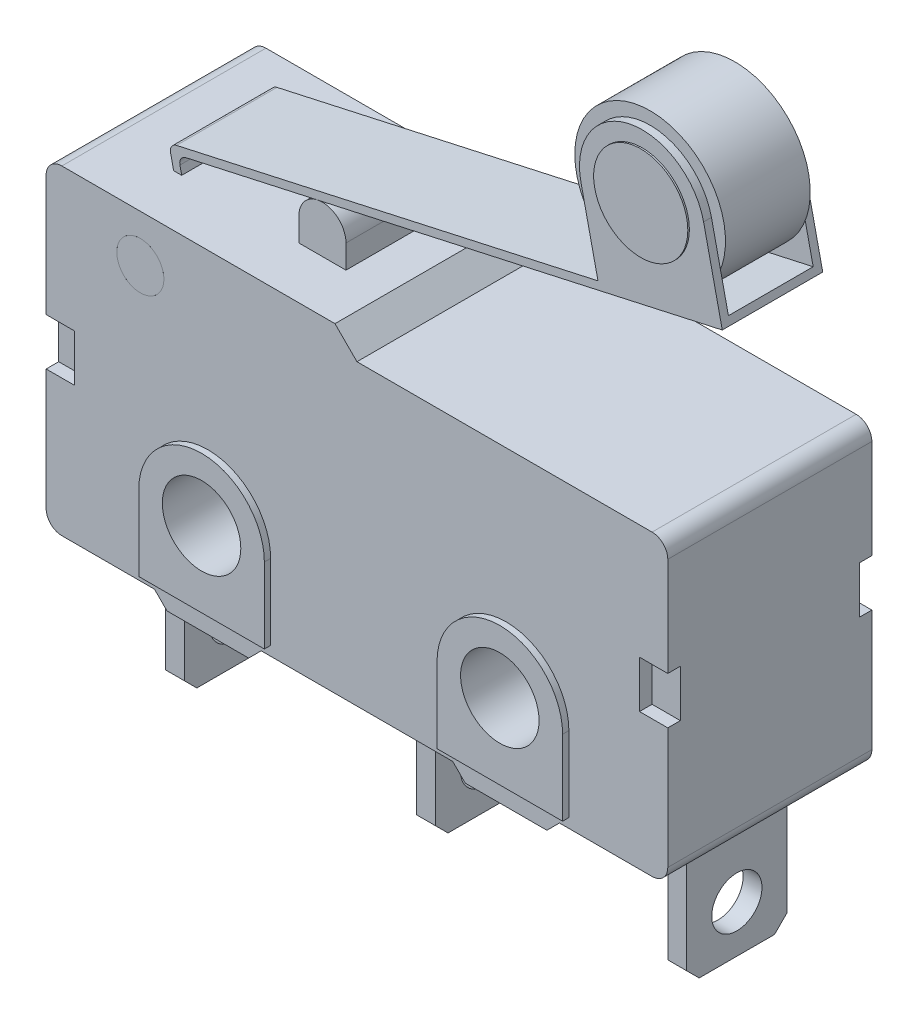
SolidWorks part; units mm, degrees
ref_plane "Front Plane" through (0, 0, 0) normal (0, 0, 1) x (1, 0, 0)
ref_plane "Top Plane" through (0, 0, 0) normal (0, 1, 0) x (1, 0, 0)
ref_plane "Right Plane" through (0, 0, 0) normal (1, 0, 0) x (0, 0, -1)
sketch "Sketch1" plane through (0, 0, 0) normal (0, 0, 1) x (1, 0, 0)
  line L0 (9.2, 10.2) -> (9.9, 9.5)
  line L1 (0.5, 0) -> (19.3, 0)
  line L2 (0, 0.5) -> (0, 9.7)
  line L3 (0.5, 10.2) -> (9.2, 10.2)
  line L4 (19.8, 0.5) -> (19.8, 9)
  line L5 (9.9, 0) -> (9.9, 9.5) construction
  line L6 (0, 5.1) -> (19.8, 5.1) construction
  line L7 (9.9, 9.5) -> (19.3, 9.5)
  arc A0 (19.8, 0.5) -> (19.3, 0) centre (19.3, 0.5) cw
  arc A1 (0.5, 0) -> (0, 0.5) centre (0.5, 0.5) cw
  arc A2 (19.8, 9) -> (19.3, 9.5) centre (19.3, 9) ccw
  arc A3 (0, 9.7) -> (0.5, 10.2) centre (0.5, 9.7) cw
  point P11 (19.8, 0)
  point P15 (0, 0)
  point P18 (19.8, 9.5)
  point P21 (0, 10.2)
  dimension "D5" = 0.5
  dimension "D1" = 10.2
  dimension "D2" = 9.5
  dimension "D3" = 19.8
  dimension "D4" = 45
extrude "Boss-Extrude1" add sketch "Sketch1" along normal mid plane 6.5
sketch "Sketch2" plane through (0, 0, 0) normal (0, 0, 1) x (1, 0, 0)
  line L0 (0.5, 0) -> (19.3, 0) construction
  line L1 (2.15, 0) -> (2.75, 0)
  line L2 (2.15, 0) -> (2.15, -4.1)
  line L3 (2.15, -4.1) -> (2.75, -4.1)
  line L4 (2.75, 0) -> (2.75, -4.1)
  line L5 (9.9, 0) -> (9.9, 9.5) construction
  line L6 (10.15, 0) -> (10.75, 0)
  line L7 (10.15, 0) -> (10.15, -4.1)
  line L8 (10.15, -4.1) -> (10.75, -4.1)
  line L9 (10.75, 0) -> (10.75, -4.1)
  line L10 (18.15, 0) -> (18.75, 0)
  line L11 (18.15, 0) -> (18.15, -4.1)
  line L12 (18.15, -4.1) -> (18.75, -4.1)
  line L13 (18.75, 0) -> (18.75, -4.1)
  dimension "D1" = 4.1
  dimension "D2" = 0.6
  dimension "D3" = 0.6
  dimension "D4" = 0.6
  dimension "D5" = 0.5
  dimension "D6" = 7.4
  dimension "D7" = 7.4
extrude "Boss-Extrude2" add sketch "Sketch2" along normal mid plane 3.2
sketch "Sketch3" plane through (18.75, 0, 0) normal (1, 0, 0) x (0, 0, -1)
  line L0 (0, -4.1) -> (0, 0) construction
  line L1 (-1.6, -4.1) -> (1.6, -4.1) construction
  line L2 (1.2, -4.1) -> (1.6, -3.7)
  line L3 (1.6, -4.1) -> (1.6, 0) construction
  line L4 (1.6, -3.7) -> (1.6, -4.1)
  line L5 (1.6, -4.1) -> (1.2, -4.1)
  line L6 (-1.6, -4.1) -> (-1.2, -4.1)
  line L7 (-1.6, -3.7) -> (-1.6, -4.1)
  line L8 (-1.2, -4.1) -> (-1.6, -3.7)
  circle A0 centre (0, -2.6) radius 0.8
  dimension "D1" = 1.6
  dimension "D2" = 1.5
  dimension "D3" = 0.4
  dimension "D4" = 0.4
extrude "Cut-Extrude1" cut sketch "Sketch3" against normal through all
sketch "Sketch5" plane through (0, 0, 3.25) normal (0, 0, 1) x (1, 0, 0)
  line L0 (5.15, 2.7) -> (14.65, 2.7) construction
  line L1 (9.9, 0) -> (9.9, 9.5) construction
  line L2 (0.5, 0) -> (19.3, 0) construction
  line L3 (0, 5.1) -> (9.9, 5.1) construction
  line L4 (0, 9.7) -> (0, 0.5) construction
  circle A0 centre (5.15, 2.7) radius 1.25
  circle A1 centre (14.65, 2.7) radius 1.25
  dimension "D1" = 2.5
  dimension "D2" = 9.5
  dimension "D3" = 4.75
  dimension "D4" = 2.4
extrude "Cut-Extrude2" cut sketch "Sketch5" against normal through all
sketch "Sketch6" plane through (0, 0, 3.25) normal (0, 0, 1) x (1, 0, 0)
  line L0 (3.15, 0.3) -> (7.15, 0.3)
  line L1 (3.15, 2.7) -> (3.15, 0.3)
  line L2 (7.15, 2.7) -> (7.15, 0.3)
  line L3 (12.65, 2.7) -> (12.65, 0.3)
  line L4 (16.65, 2.7) -> (16.65, 0.3)
  line L5 (12.65, 0.3) -> (16.65, 0.3)
  line L6 (0.5, 0) -> (19.3, 0) construction
  circle A0 centre (5.15, 2.7) radius 1.25
  circle A1 centre (14.65, 2.7) radius 1.25
  arc A2 (16.65, 2.7) -> (12.65, 2.7) centre (14.65, 2.7) ccw
  arc A3 (7.15, 2.7) -> (3.15, 2.7) centre (5.15, 2.7) ccw
  dimension "D2" = 2
  dimension "D3" = 2.5
  dimension "D1" = 0.3
extrude "Boss-Extrude3" add sketch "Sketch6" along normal blind 0.2
mirror "Mirror1" about plane through (0, 0, 0) normal (0, 0, 1) of "Boss-Extrude3"
sketch "Sketch7" plane through (0, 0, 3.25) normal (0, 0, 1) x (1, 0, 0)
  line L0 (3.45, 0) -> (3.85, -0.4)
  line L1 (0.5, 0) -> (19.3, 0) construction
  line L2 (3.85, -0.4) -> (6.45, -0.4)
  line L3 (6.45, -0.4) -> (6.85, 0)
  line L4 (12.95, 0) -> (13.35, -0.4)
  line L5 (13.35, -0.4) -> (15.95, -0.4)
  line L6 (15.95, -0.4) -> (16.35, 0)
  line L7 (16.35, 0) -> (12.95, 0)
  line L8 (6.85, 0) -> (3.45, 0)
  line L9 (5.15, -0.4) -> (5.15, 2.7) construction
  line L10 (14.65, -0.4) -> (14.65, 2.7) construction
  dimension "D1" = 45
  dimension "D2" = 45
  dimension "D3" = 45
  dimension "D4" = 0.4
  dimension "D5" = 0.3
  dimension "D6" = 0.3
extrude "Boss-Extrude4" add sketch "Sketch7" against normal up to surface (6.5 mm away)
sketch "Sketch8" plane through (0, 0, 3.25) normal (0, 0, 1) x (1, 0, 0)
  line L0 (0, 5.1) -> (20.8743, 5.1) construction
  line L1 (0, 9.7) -> (0, 0.5) construction
  line L2 (9.9, 0) -> (9.9, 5.1) construction
  line L3 (0, 5.85) -> (0.9, 5.85)
  line L4 (0, 5.85) -> (0, 4.35)
  line L5 (0, 4.35) -> (0.9, 4.35)
  line L6 (0.9, 5.85) -> (0.9, 4.35)
  line L7 (6.85, 0) -> (12.95, 0) construction
  line L8 (19.8, 5.85) -> (19.8, 4.35)
  line L9 (19.8, 4.35) -> (18.9, 4.35)
  line L10 (18.9, 5.85) -> (18.9, 4.35)
  line L11 (19.8, 5.85) -> (18.9, 5.85)
  dimension "D1" = 0.9
  dimension "D2" = 1.5
  dimension "D3" = 0.75
extrude "Cut-Extrude3" cut sketch "Sketch8" against normal blind 0.4
mirror "Mirror2" about plane through (0, 0, 0) normal (0, 0, 1) of "Cut-Extrude3"
sketch "Sketch9" plane through (0, 0, 3.25) normal (0, 0, 1) x (1, 0, 0)
  line L0 (9.2, 10.2) -> (0.5, 10.2) construction
  line L1 (0, 9.7) -> (0, 5.85) construction
  circle A0 centre (3, 8.7) radius 0.75
  dimension "D1" = 1.5
  dimension "D2" = 1.5
  dimension "D3" = 3
extrude "Cut-Extrude4" cut sketch "Sketch9" against normal through all
sketch "Sketch10" plane through (0, 0, 0) normal (0, 0, 1) x (1, 0, 0)
  circle A0 centre (3, 8.7) radius 0.75
  dimension "D1" = 1.5
extrude "Boss-Extrude6" add sketch "Sketch10" along normal mid plane 6.5 separate body
sketch "Sketch11" plane through (0, 10.2, 0) normal (0, 1, 0) x (1, 0, 0)
  line L0 (0, 0) -> (6.4, 0) construction
  line L1 (6.4, 1.6) -> (7.9, 1.6)
  line L2 (6.4, 1.6) -> (6.4, -1.6)
  line L3 (6.4, -1.6) -> (7.9, -1.6)
  line L4 (7.9, 1.6) -> (7.9, -1.6)
  line L5 (9.2, -3.25) -> (9.2, 3.25) construction
  dimension "D1" = 3.2
  dimension "D2" = 1.3
  dimension "D3" = 1.5
extrude "Boss-Extrude7" add sketch "Sketch11" along normal blind 0.75 separate body
sketch "Sketch12" plane through (0, 0, 1.6) normal (0, 0, 1) x (1, 0, 0)
  line L0 (6.4, 10.95) -> (7.9, 10.95) construction
  line L1 (6.4, 10.95) -> (7.9, 10.95)
  arc A0 (7.9, 10.95) -> (6.4, 10.95) centre (7.15, 10.95) ccw
extrude "Boss-Extrude8" add sketch "Sketch12" against normal up to surface (3.2 mm away)
sketch "Sketch13" plane through (0, 0, 0) normal (0, 0, 1) x (1, 0, 0)
  line L0 (2.8007, 10.754) -> (19.8859, 14.5417)
  line L1 (2.4114, 10.2) -> (2.3126, 10.6458)
  line L2 (2.5025, 10.944) -> (19.8318, 14.7858)
  line L3 (3, 8.7) -> (3, 13.8125) construction
  line L4 (2.6675, 10.2) -> (2.6107, 10.4558)
  line L5 (3.8176, 10.9794) -> (17.7373, 14.0654) construction
  line L6 (9.2, 10.2) -> (0.5, 10.2) construction
  line L7 (3.7635, 11.2235) -> (17.6832, 14.3094) construction
  line L8 (2.7559, 8.6459) -> (2.3126, 10.6458) construction
  line L10 (19.8859, 14.5417) -> (19.8318, 14.7858)
  line L11 (3, 8.7) -> (2.5566, 10.6999) construction
  line L12 (2.6675, 10.2) -> (2.4114, 10.2)
  arc A0 (7.9, 10.95) -> (6.4, 10.95) centre (7.15, 10.95) ccw construction
  arc A1 (2.3126, 10.6458) -> (2.5025, 10.944) centre (2.5566, 10.6999) cw
  arc A2 (2.6107, 10.4558) -> (2.8007, 10.754) centre (2.8548, 10.5099) cw
  dimension "D4" = 0.25
  dimension "D5" = 18
  dimension "D1" = 0.25
  dimension "D3" = 12.5
  dimension "D2" = 0.25
extrude "Boss-Extrude10" add sketch "Sketch13" along normal mid plane 3.2 separate body
sketch "Sketch14" plane through (0, 0, 0) normal (0, 0, 1) x (1, 0, 0)
  line L0 (19.8318, 14.7858) -> (19.2907, 17.2265)
  line L1 (15.3855, 16.3607) -> (19.2907, 17.2265) construction
  line L2 (15.3855, 16.3607) -> (15.9266, 13.92)
  line L3 (19.8318, 14.7858) -> (2.5025, 10.944) construction
  line L4 (15.9266, 13.92) -> (19.8318, 14.7858)
  arc A0 (19.2907, 17.2265) -> (15.3855, 16.3607) centre (17.3381, 16.7936) ccw
  circle A1 centre (17.3381, 16.7936) radius 1.5
  dimension "D1" = 2
  dimension "D2" = 3
  dimension "D3" = 2.5
extrude "Boss-Extrude11" add sketch "Sketch14" along normal mid plane 3.2
sketch "Sketch15" plane through (22.0271, 4.8833, 0) normal (0.9763, 0.2164, 0) x (0, 0, -1)
  line L0 (-1.6, 9.8929) -> (1.6, 9.8929) construction
  line L1 (-1.35, 15.3352) -> (1.35, 15.3352)
  line L2 (-1.35, 15.3352) -> (-1.35, 10.1429)
  line L3 (-1.35, 10.1429) -> (1.35, 10.1429)
  line L4 (1.35, 15.3352) -> (1.35, 10.1429)
  line L5 (1.6, 9.8929) -> (1.6, 12.6429) construction
  line L6 (-1.6, 9.8929) -> (-1.6, 12.6429) construction
  point P6 (1.6, 11.2679)
  dimension "D1" = 0.25
  dimension "D2" = 0.25
  dimension "D3" = 0.25
extrude "Cut-Extrude5" cut sketch "Sketch15" against normal blind 13.2
sketch "Sketch16" plane through (0, 0, 0) normal (0, 0, 1) x (1, 0, 0)
  circle A0 centre (17.3381, 16.7936) radius 2.4
  dimension "D1" = 4.8
extrude "Boss-Extrude12" add sketch "Sketch16" along normal mid plane 2.7 separate body
sketch "Sketch17" plane through (0, 0, 1.35) normal (0, 0, 1) x (1, 0, 0)
  circle A0 centre (17.3381, 16.7936) radius 1.5
extrude "Boss-Extrude13" add sketch "Sketch17" along normal blind 0.3
mirror "Mirror4" about plane through (0, 0, 0) normal (0, 0, 1) of "Boss-Extrude13"
